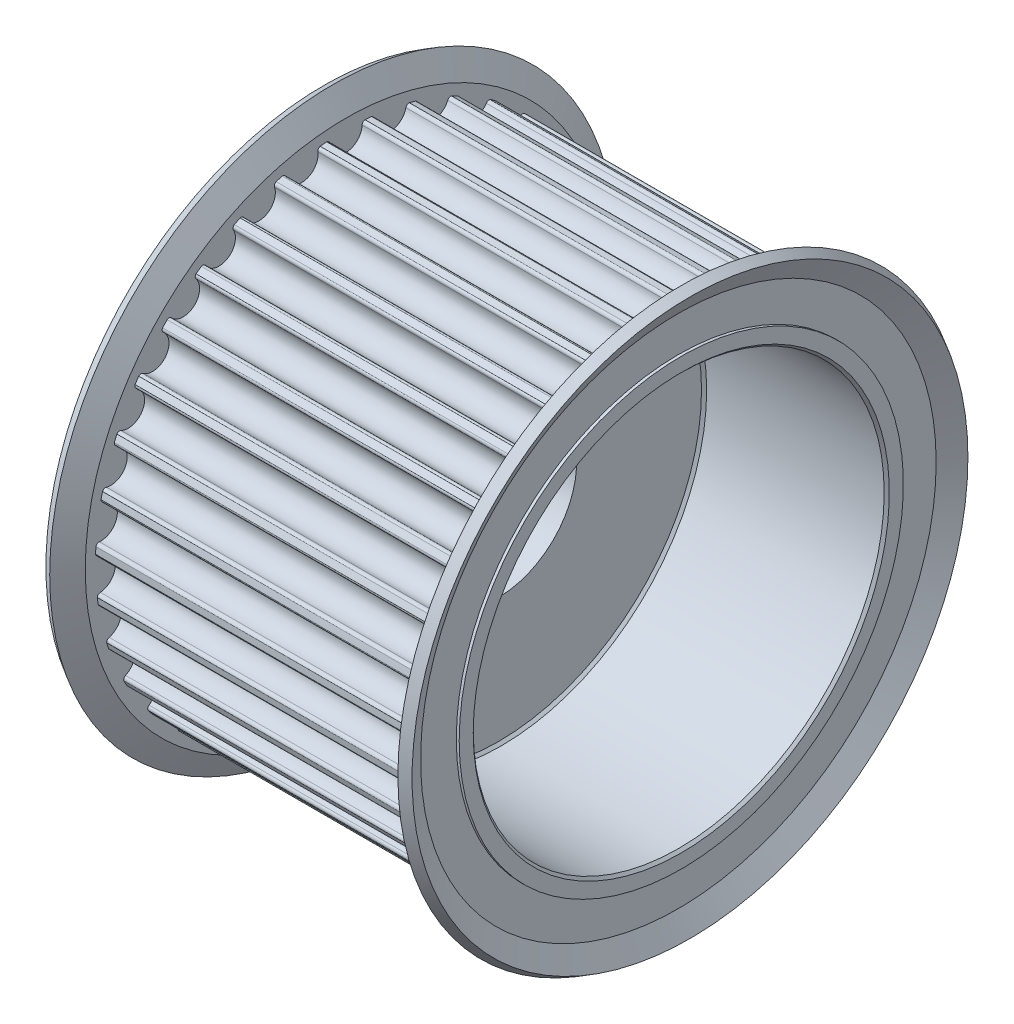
SolidWorks part; units mm, degrees
ref_plane "Front" through (0, 0, 0) normal (0, 0, 1) x (1, 0, 0)
ref_plane "Top" through (0, 0, 0) normal (0, 1, 0) x (1, 0, 0)
ref_plane "Right" through (0, 0, 0) normal (1, 0, 0) x (0, 0, -1)
sketch "Sketch1" plane through (0, 0, 0) normal (0, 0, 1) x (1, 0, 0)
  line L0 (0, 0) -> (118.7355, 0) construction
  line L1 (50.8, 23.876) -> (0, 23.876)
  line L2 (102.616, 67.9386) -> (102.616, 76.5874)
  line L3 (4.064, 76.5874) -> (102.616, 76.5874)
  line L4 (0, 67.9387) -> (0, 23.876)
  line L5 (106.68, 62.8586) -> (50.8, 62.8586)
  line L6 (50.8, 62.8586) -> (50.8, 23.876)
  line L7 (102.616, 67.9386) -> (106.68, 67.9386)
  line L8 (106.68, 67.9386) -> (106.68, 62.8586)
  line L9 (0, 67.9387) -> (4.064, 67.9387)
  line L10 (4.064, 67.9387) -> (4.064, 76.5874)
  dimension "D1" = 98.552
  dimension "D2" = 106.68
  dimension "D3" = 153.1747
  dimension "D4" = 55.88
  dimension "D5" = 47.752
  dimension "D6" = 8.6487
  dimension "D8" = 5.08
revolve "Revolve1" add sketch "Sketch1" angle 360 about L0
sketch "Sketch2" plane through (102.616, 0, 0) normal (1, 0, 0) x (0, 0, -1)
  line L0 (0, 0) -> (0, 78.0907) construction
  line L1 (0, 0) -> (6.9718, 77.4633) construction
  line L2 (0, 0) -> (13.9436, 76.8358) construction
  line L3 (0, 78.0907) -> (13.9436, 76.8358) construction
  arc A0 (-4.9966, 75.407) -> (4.9966, 75.407) centre (0, 75.5907) ccw
  arc A1 (4.9966, 75.407) -> (5.8687, 76.3622) centre (5.9959, 75.3703) cw
  arc A2 (-4.9966, 75.407) -> (-5.8687, 76.3622) centre (-5.9959, 75.3703) ccw
  circle A3 centre (0, 0) radius 76.5874 construction
  arc A5 (5.8687, 76.3622) -> (-5.8687, 76.3622) centre (0, 75.5907) ccw
  dimension "D1" = 5
  dimension "D2" = 10.286
  dimension "D4" = 1
  dimension "D5" = 2.5
  dimension "D6" = 1
  dimension "D3" = 14
extrude "Cut-Extrude1" cut sketch "Sketch2" against normal through all
pattern_circular "CircPattern1" count 35 over 360 about axis through (0, 0, 0) along (1, 0, 0) of "Cut-Extrude1"
chamfer "Chamfer1" distance 0.7874 angle 45 2 edges at (50.8, 0, 62.8586) (106.68, 0, 62.8586)
sketch "Sketch4" plane through (0, 0, 0) normal (0, 0, 1) x (1, 0, 0)
  line L0 (102.616, 67.9386) -> (102.616, 79.7114)
  line L1 (102.616, 79.7114) -> (106.5976, 86.6076)
  line L2 (106.5976, 86.6076) -> (109.3472, 85.0201)
  line L3 (109.3472, 85.0201) -> (105.791, 78.8606)
  line L4 (105.791, 78.8606) -> (105.791, 67.9386)
  line L5 (106.68, 67.9386) -> (102.616, 67.9386) construction
  line L6 (105.791, 67.9386) -> (102.616, 67.9386)
  line L7 (53.34, 76.1829) -> (53.34, 118.2187) construction
  line L8 (0, 0) -> (-25.0616, 0) construction
  line L9 (4.064, 76.1829) -> (102.616, 76.1829) construction
  line L10 (0.889, 67.9386) -> (4.064, 67.9386)
  line L11 (0.889, 78.8606) -> (0.889, 67.9386)
  line L12 (-2.6672, 85.0201) -> (0.889, 78.8606)
  line L13 (0.0824, 86.6076) -> (-2.6672, 85.0201)
  line L14 (4.064, 79.7114) -> (0.0824, 86.6076)
  line L15 (4.064, 67.9386) -> (4.064, 79.7114)
  dimension "D1" = 18.669
  dimension "D2" = 150
  dimension "D3" = 3.175
  dimension "D4" = 10.922
revolve "Revolve2" add sketch "Sketch4" angle 360 about L8
equation "\"Teeth\"=35"
equation "\"D2@Sketch2\"=360/\"Teeth\""
equation "\"D3@Sketch1\"=\"Teeth\"*.1723"
